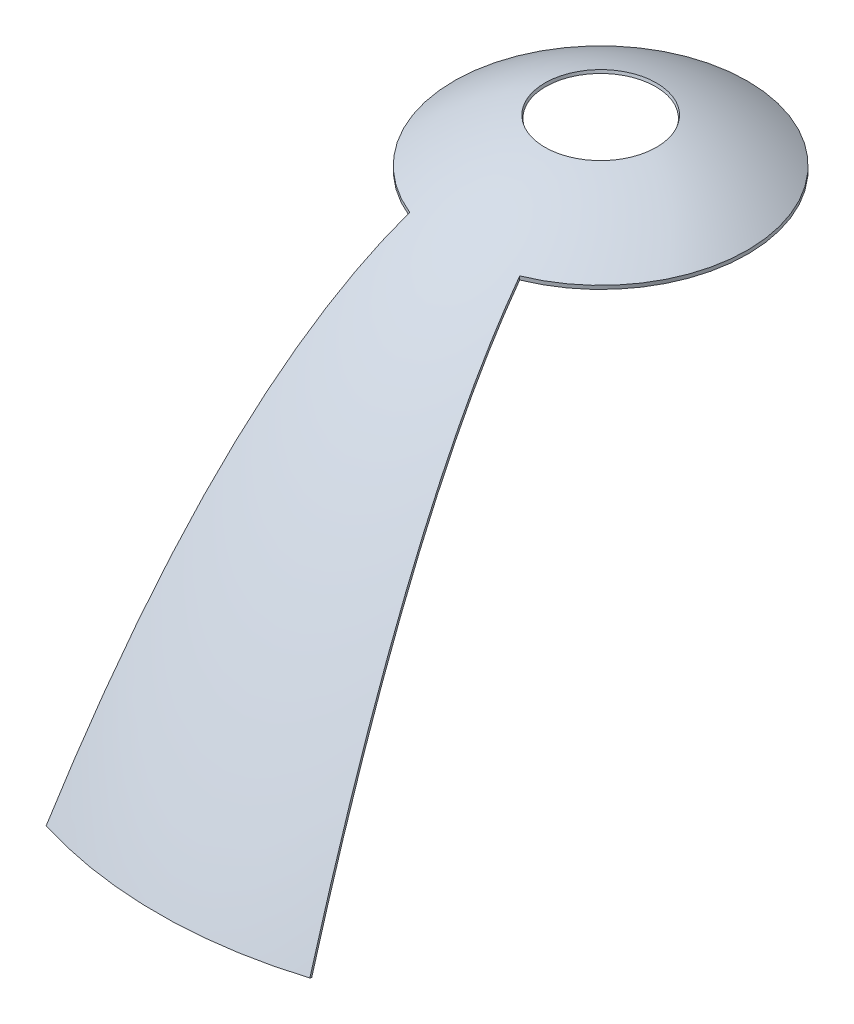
SolidWorks part; units mm, degrees
ref_plane "Ebene vorne" through (0, 0, 0) normal (0, 0, 1) x (1, 0, 0)
ref_plane "Ebene oben" through (0, 0, 0) normal (0, 1, 0) x (1, 0, 0)
ref_plane "Ebene rechts" through (0, 0, 0) normal (1, 0, 0) x (0, 0, -1)
sketch "Skizze1" plane through (0, 0, 0) normal (0, 0, 1) x (1, 0, 0)
  line L0 (0, 0) -> (0, 50) construction
  line L1 (0, 0) -> (-95.7252, 0) construction
  line L2 (-60.3646, 0.1645) -> (-60, 0)
  line L3 (-7.6037, 64.2466) -> (-7.5, 63.8602)
  parabola Q0
  spline S0 degree 1 poles (-60.3646, 0.1645) (-7.6037, 64.2466) knots 0 0 1 1 construction
  spline S1 degree 3 poles (-60.3646, 0.1645) (-59.8377, 1.3324) (-58.7624, 3.6815) (-56.6295, 8.2037) (-53.9488, 13.632) (-50.7234, 19.7538) (-46.4061, 27.4054) (-40.9799, 36.0066) (-34.4185, 44.7891) (-27.8054, 52.0322) (-21.134, 57.7361) (-15.5312, 61.2016) (-11.0024, 63.2032) (-8.7561, 63.9373) (-7.6037, 64.2466) knots 0.496025 0.496025 0.496025 0.496025 0.496135 0.496245 0.496465 0.496684 0.496904 0.497343 0.497783 0.498222 0.498661 0.499101 0.49932 0.49954 0.49954 0.49954 0.49954
  dimension "D1" = 50
  dimension "D2" = 120
  dimension "D3" = 15
  dimension "D4" = 0.4
revolve "Rotation1" add sketch "Skizze1" angle 360 about L0
sketch "Skizze3" plane through (0, 0, 0) normal (0, 1, 0) x (1, 0, 0)
  line L0 (-7.5, -18.5405) -> (-17.9732, -57.6268)
  line L1 (-17.9732, -57.6268) -> (-17.9732, -70.6598)
  line L2 (0, 0) -> (0, -72.0779) construction
  line L3 (17.9732, -57.6268) -> (17.9732, -70.6598)
  line L4 (7.5, -18.5405) -> (17.9732, -57.6268)
  line L5 (17.9732, -70.6598) -> (-17.9732, -70.6598)
  arc A0 (7.5, -18.5405) -> (-7.5, -18.5405) centre (0, 0) ccw
  circle A1 centre (0, 0) radius 60.3646 construction
  dimension "D1" = 20
  dimension "D2" = 30
  dimension "D3" = 15
extrude "Linear austragen2" cut sketch "Skizze3" against normal blind 46 and the other way blind 80 flip side to cut
